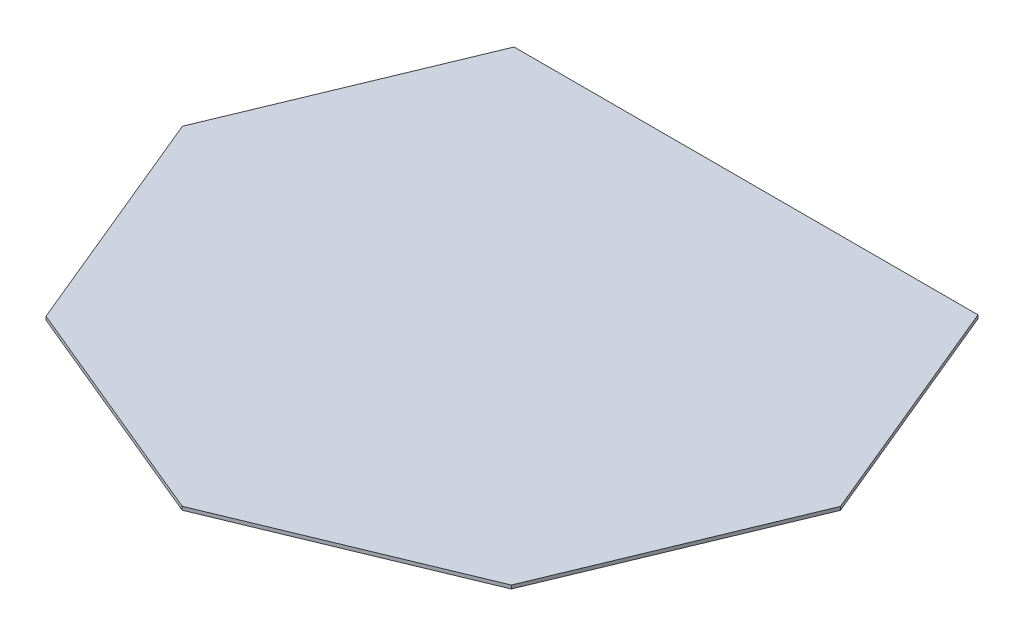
SolidWorks part; units mm, degrees
ref_plane "Plan de face" through (0, 0, 0) normal (0, 0, 1) x (1, 0, 0)
ref_plane "Plan de dessus" through (0, 0, 0) normal (0, 1, 0) x (1, 0, 0)
ref_plane "Plan de droite" through (0, 0, 0) normal (1, 0, 0) x (0, 0, -1)
sketch "Esquisse1" plane through (0, 0, 0) normal (0, 1, 0) x (1, 0, 0)
  line L0 (-675.581, 683.2786) -> (675.8154, 683.2786)
  line L1 (-958.7214, 0.2786) -> (-678.1154, -677.7214)
  line L2 (-678.1154, -677.7214) -> (-0.2786, -958.7214)
  line L3 (-0.2786, -958.7214) -> (677.7214, -678.1154)
  line L4 (677.7214, -678.1154) -> (958.7214, -0.2786)
  line L5 (958.7214, -0.2786) -> (675.8154, 683.2786)
  line L8 (-675.581, 683.2786) -> (-958.7214, 0.2786)
  line L11 (-373.5507, 804.0035) -> (-580.9141, 718.1814)
  line L12 (688.6996, 673.3337) -> (341.0217, 817.4649)
  circle A0 centre (0, 0) radius 958.7214 construction
  circle A1 centre (0, 0) radius 885.7431 construction
  dimension "D1" = 683
  dimension "D3" = 281
  dimension "D2" = 678
extrude "Boss.-Extru.1" add sketch "Esquisse1" along normal blind 10
